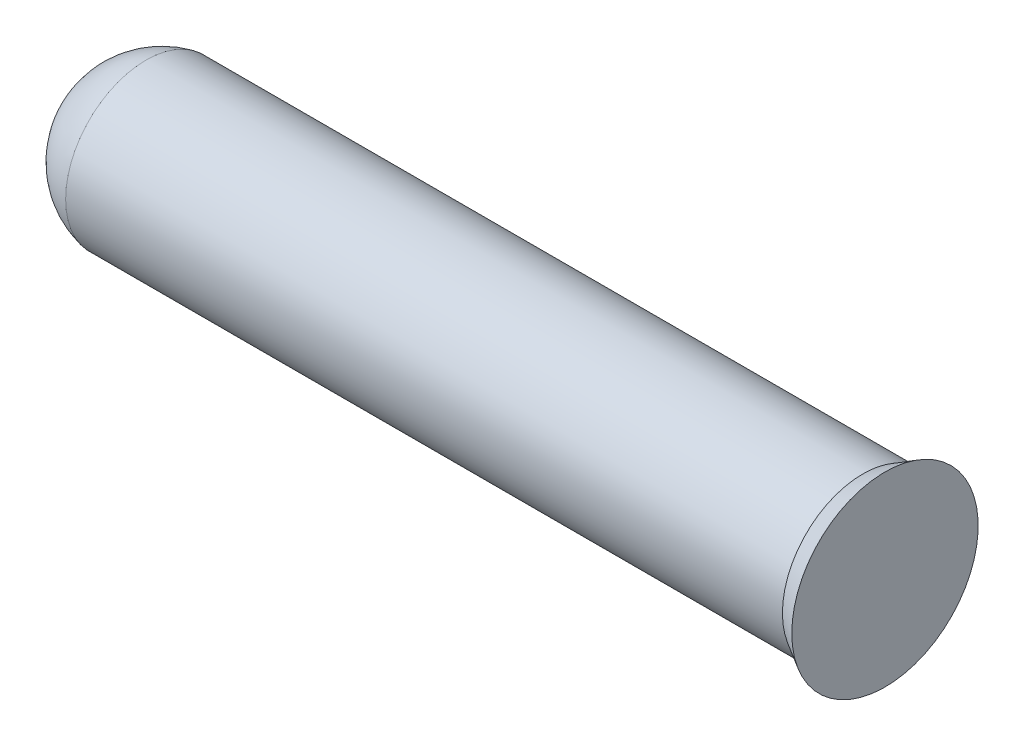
SolidWorks part; units mm, degrees
ref_plane "Front Plane" through (0, 0, 0) normal (0, 0, 1) x (1, 0, 0)
ref_plane "Top Plane" through (0, 0, 0) normal (0, 1, 0) x (1, 0, 0)
ref_plane "Right Plane" through (0, 0, 0) normal (1, 0, 0) x (0, 0, -1)
sketch "Sketch1" plane through (0, 0, 0) normal (0, 0, 1) x (1, 0, 0)
  line L0 (0, 0) -> (19.964, 0)
  line L1 (19.964, 0) -> (19.964, 2.311)
  line L2 (19.964, 2.311) -> (19.4149, 1.994)
  line L3 (19.4149, 1.994) -> (1.6409, 1.994)
  arc A0 (1.6409, 1.994) -> (0, 0) centre (2.032, 0) ccw
  dimension "D5" = 4.064
  dimension "D1" = 19.964
  dimension "D3" = 2.311
  dimension "D4" = 30
revolve "Revolve1" add sketch "Sketch1" angle 360 about L0
